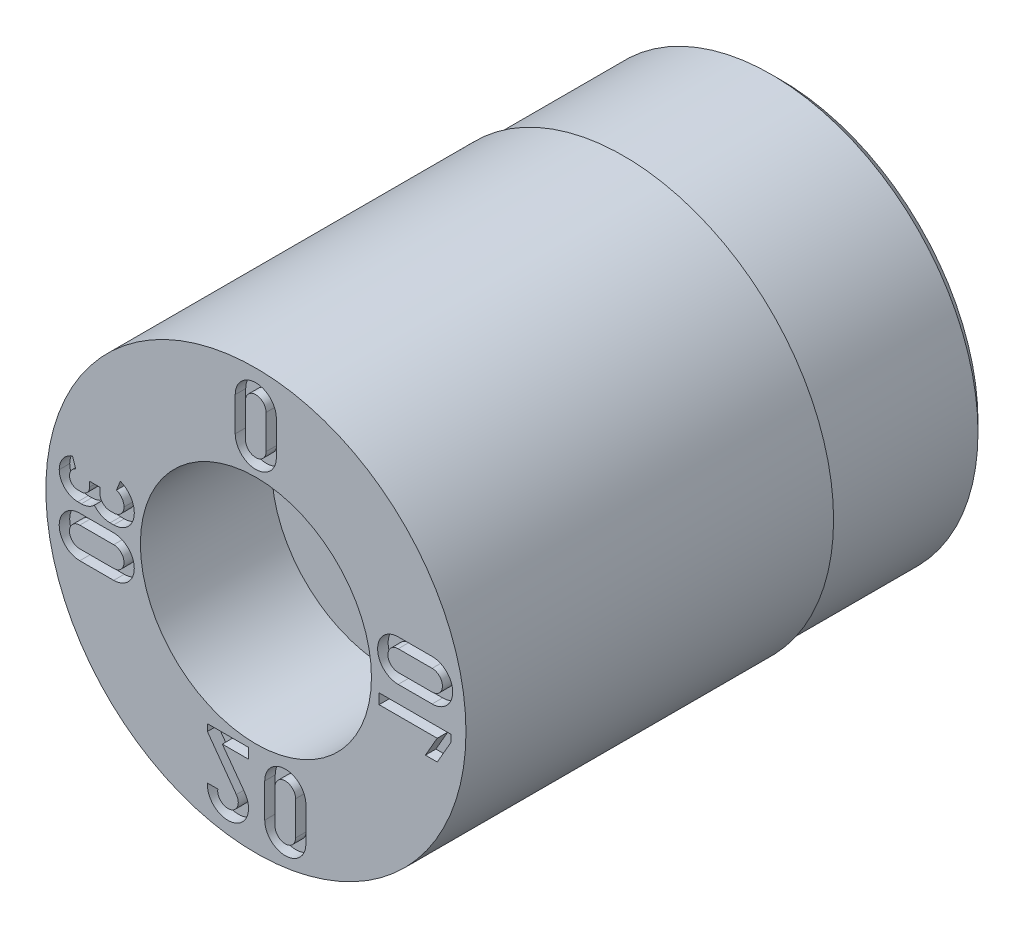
SolidWorks part; units mm, degrees
ref_plane "Front Plane" through (0, 0, 0) normal (0, 0, 1) x (1, 0, 0)
ref_plane "Top Plane" through (0, 0, 0) normal (0, 1, 0) x (1, 0, 0)
ref_plane "Right Plane" through (0, 0, 0) normal (1, 0, 0) x (0, 0, -1)
sketch "Sketch1" plane through (0, 0, 0) normal (1, 0, 0) x (0, 0, -1)
  line L2 (0, 4) -> (0, 2.2)
  line L3 (9.75, 4) -> (0, 4)
  line L4 (-3.7979, 0) -> (49996.2021, 0) construction
  line L8 (10, 1.15) -> (2.5, 1.15)
  line L9 (2.5, 2.2) -> (2.5, 1.15)
  line L10 (2.5, 2.2) -> (0, 2.2)
  line L12 (10, 1.15) -> (10, 3.75)
  line L16 (10, 3.75) -> (9.75, 4)
  dimension "D1" = 10
  dimension "D2" = 45
  dimension "D3" = 0.25
  dimension "D4" = 8
  dimension "D5" = 4.4
  dimension "D6" = 2.5
  dimension "D7" = 2.3
revolve "Revolve1" add sketch "Sketch1" angle 360 about L4
sketch "Sketch4" plane through (0, 0, 0) normal (1, 0, 0) x (0, 0, -1)
  line L0 (0, 0) -> (50000, 0) construction
  line L1 (10, -3.75) -> (10, 3.75) construction
  line L2 (7, 4.935) -> (10, 4.935)
  line L3 (7, 4.935) -> (7, 3.935)
  line L4 (7, 3.935) -> (10, 3.935)
  line L5 (10, 4.935) -> (10, 3.935)
  line L6 (9.75, 4) -> (0, 4) construction
  line L9 (0, 4.4) -> (0, -4.4) construction
  dimension "D1" = 1
  dimension "D2" = 0.065
  dimension "D3" = 7
revolve "Cut-Revolve1" cut sketch "Sketch4" angle 360 about L0
sketch "Sketch2" plane through (0, 0, 0) normal (0, 0, 1) x (1, 0, 0)
  line L460 (0.364, -2.7249) -> (0.364, -3.3712)
  line L461 (0.7556, -3.3711) -> (0.7557, -2.7249)
  line L462 (0.9516, -3.3711) -> (0.9516, -2.7249)
  line L463 (0.168, -2.7249) -> (0.1681, -3.3712)
  line L464 (-2.7073, 0.2555) -> (-2.7759, 0.2555)
  line L465 (-2.9716, 0.4513) -> (-2.9716, 0.5492)
  line L466 (-2.9716, 0.5492) -> (-3.1675, 0.5492)
  line L467 (-3.1675, 0.5492) -> (-3.1675, 0.4514)
  line L468 (-3.3242, 0.2947) -> (-3.3927, 0.2947)
  line L469 (-3.4295, 0.6184) -> (-3.4922, 0.8039)
  line L470 (-3.3927, 0.0989) -> (-3.3242, 0.0989)
  line L471 (-2.7759, 0.0597) -> (-2.7073, 0.0597)
  line L472 (-2.5821, 0.843) -> (-2.654, 0.6609)
  line L473 (3.3557, 0.9217) -> (2.7094, 0.9217)
  line L474 (2.7095, 0.1382) -> (3.3557, 0.1382)
  line L475 (2.7095, 0.3341) -> (3.3557, 0.3341)
  line L476 (3.3557, 0.7258) -> (2.7094, 0.7258)
  line L477 (3.7167, -0.1827) -> (3.7167, -0.3116)
  line L478 (3.7167, -0.3116) -> (3.453, -0.7702)
  line L479 (3.453, -0.7702) -> (3.2272, -0.7703)
  line L480 (3.2272, -0.7703) -> (3.4523, -0.3786)
  line L481 (3.4523, -0.3786) -> (2.3458, -0.3787)
  line L482 (2.3458, -0.3787) -> (2.3458, -0.1828)
  line L483 (2.3458, -0.1828) -> (3.7167, -0.1827)
  line L484 (-0.1402, -2.5214) -> (-0.1402, -2.3255)
  line L485 (-0.1402, -2.3255) -> (-0.9235, -2.3256)
  line L486 (-0.9235, -2.3256) -> (-0.9235, -2.4551)
  line L487 (-0.9235, -2.4551) -> (-0.3728, -3.2196)
  line L488 (-0.7254, -3.3047) -> (-0.9224, -3.3047)
  line L489 (-0.2136, -3.1049) -> (-0.6396, -2.5214)
  line L490 (-0.6396, -2.5214) -> (-0.1402, -2.5214)
  line L491 (-0.394, 3.3645) -> (-0.3939, 2.7182)
  line L492 (0.3894, 2.7183) -> (0.3895, 3.3646)
  line L493 (0.1936, 2.7183) -> (0.1935, 3.3646)
  line L494 (-0.1981, 3.3645) -> (-0.1981, 2.7182)
  line L495 (-2.7078, -0.6588) -> (-3.3541, -0.6586)
  line L496 (-3.3541, -0.267) -> (-2.7078, -0.2669)
  line L497 (-3.354, -0.0711) -> (-2.7078, -0.0711)
  line L498 (-2.7078, -0.8546) -> (-3.3541, -0.8545)
  arc A216 (0.7557, -2.7249) -> (0.364, -2.7249) centre (0.5598, -2.7249) ccw
  arc A217 (0.364, -3.3712) -> (0.7556, -3.3711) centre (0.5598, -3.3712) ccw
  arc A218 (0.9516, -2.7249) -> (0.168, -2.7249) centre (0.5598, -2.7249) ccw
  arc A219 (0.1681, -3.3712) -> (0.9516, -3.3711) centre (0.5598, -3.3712) ccw
  arc A220 (-2.5115, 0.4513) -> (-2.654, 0.6609) centre (-2.7367, 0.4514) ccw
  arc A221 (-2.7073, 0.2555) -> (-2.5115, 0.4513) centre (-2.7073, 0.4514) ccw
  arc A222 (-2.9716, 0.4513) -> (-2.7759, 0.2555) centre (-2.7758, 0.4513) ccw
  arc A223 (-3.3242, 0.2947) -> (-3.1675, 0.4514) centre (-3.3241, 0.4514) ccw
  arc A224 (-3.5493, 0.4514) -> (-3.3927, 0.2947) centre (-3.3925, 0.4515) ccw
  arc A225 (-3.4295, 0.6184) -> (-3.5493, 0.4514) centre (-3.3733, 0.4516) ccw
  arc A226 (-3.4922, 0.8039) -> (-3.7452, 0.4514) centre (-3.373, 0.4513) ccw
  arc A227 (-3.7452, 0.4514) -> (-3.3927, 0.0989) centre (-3.3927, 0.4513) ccw
  arc A228 (-3.3242, 0.0989) -> (-3.0766, 0.2004) centre (-3.3241, 0.4512) ccw
  arc A229 (-3.0766, 0.2004) -> (-2.7759, 0.0597) centre (-2.7759, 0.4512) ccw
  arc A230 (-2.7073, 0.0597) -> (-2.3156, 0.4513) centre (-2.7073, 0.4513) ccw
  arc A231 (-2.3156, 0.4513) -> (-2.5821, 0.843) centre (-2.7368, 0.4513) ccw
  arc A232 (2.7094, 0.9217) -> (2.7095, 0.1382) centre (2.7095, 0.5299) ccw
  arc A233 (3.3557, 0.1382) -> (3.3557, 0.9217) centre (3.3557, 0.53) ccw
  arc A234 (2.7094, 0.7258) -> (2.7095, 0.3341) centre (2.7095, 0.5299) ccw
  arc A235 (3.3557, 0.3341) -> (3.3557, 0.7258) centre (3.3557, 0.53) ccw
  arc A236 (-0.7254, -3.3047) -> (-0.3728, -3.2196) centre (-0.5317, -3.3341) ccw
  arc A237 (-0.9224, -3.3047) -> (-0.2136, -3.1049) centre (-0.5316, -3.3339) ccw
  arc A238 (-0.3939, 2.7182) -> (0.3894, 2.7183) centre (-0.0023, 2.7183) ccw
  arc A239 (0.3895, 3.3646) -> (-0.394, 3.3645) centre (-0.0023, 3.3645) ccw
  arc A240 (-0.1981, 2.7182) -> (0.1936, 2.7183) centre (-0.0023, 2.7183) ccw
  arc A241 (0.1935, 3.3646) -> (-0.1981, 3.3645) centre (-0.0023, 3.3645) ccw
  arc A242 (-2.7078, -0.6588) -> (-2.7078, -0.2669) centre (-2.7078, -0.4629) ccw
  arc A243 (-3.3541, -0.267) -> (-3.3541, -0.6586) centre (-3.3541, -0.4628) ccw
  arc A244 (-2.7078, -0.8546) -> (-2.7078, -0.0711) centre (-2.7078, -0.4629) ccw
  arc A245 (-3.354, -0.0711) -> (-3.3541, -0.8545) centre (-3.3541, -0.4628) ccw
  point P890 (0, 0.0063)
  point P891 (0.0063, 0.0063)
  point P892 (0.0063, 0)
extrude "Cut-Extrude1" cut sketch "Sketch2" against normal blind 0.2
